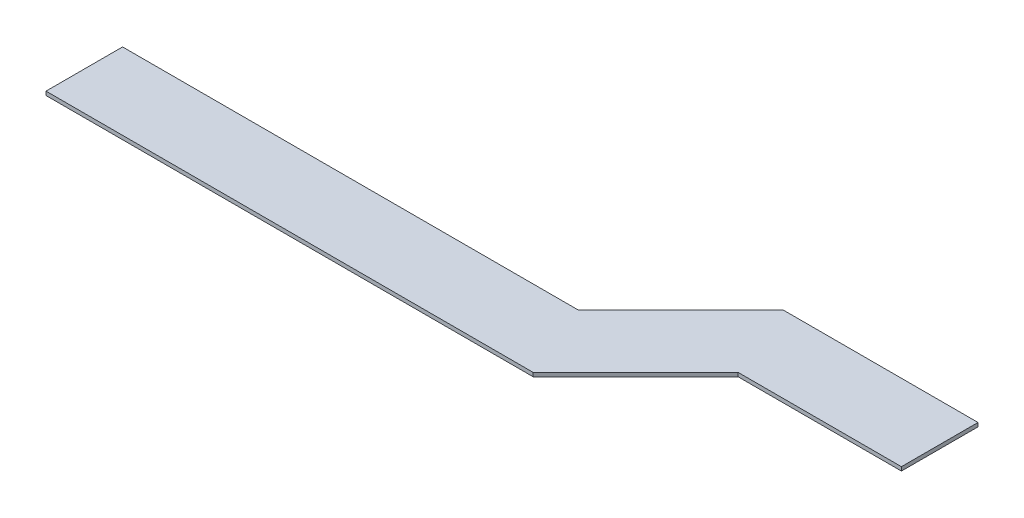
SolidWorks part; units mm, degrees
ref_plane "Plan de face" through (0, 0, 0) normal (0, 0, 1) x (1, 0, 0)
ref_plane "Plan de dessus" through (0, 0, 0) normal (0, 1, 0) x (1, 0, 0)
ref_plane "Plan de droite" through (0, 0, 0) normal (1, 0, 0) x (0, 0, -1)
sketch "Esquisse1" plane through (0, 0, 0) normal (0, 1, 0) x (1, 0, 0)
  line L0 (0, 0) -> (0, -60)
  line L1 (0, -60) -> (-128, -60)
  line L2 (-128, -60) -> (-208.3, -140.3)
  line L3 (-208.3, -140.3) -> (-590, -140.3)
  line L4 (-590, -140.3) -> (-590, -80.3)
  line L5 (-590, -80.3) -> (-233.2, -80.3)
  line L6 (-233.2, -80.3) -> (-152.9, 0)
  line L7 (-152.9, 0) -> (0, 0)
  dimension "D1" = 590
  dimension "D2" = 381.7
  dimension "D3" = 356.8
  dimension "D4" = 152.9
  dimension "D5" = 128
  dimension "D6" = 60
  dimension "D7" = 80.3
extrude "Extrusion1" add sketch "Esquisse1" along normal blind 3
